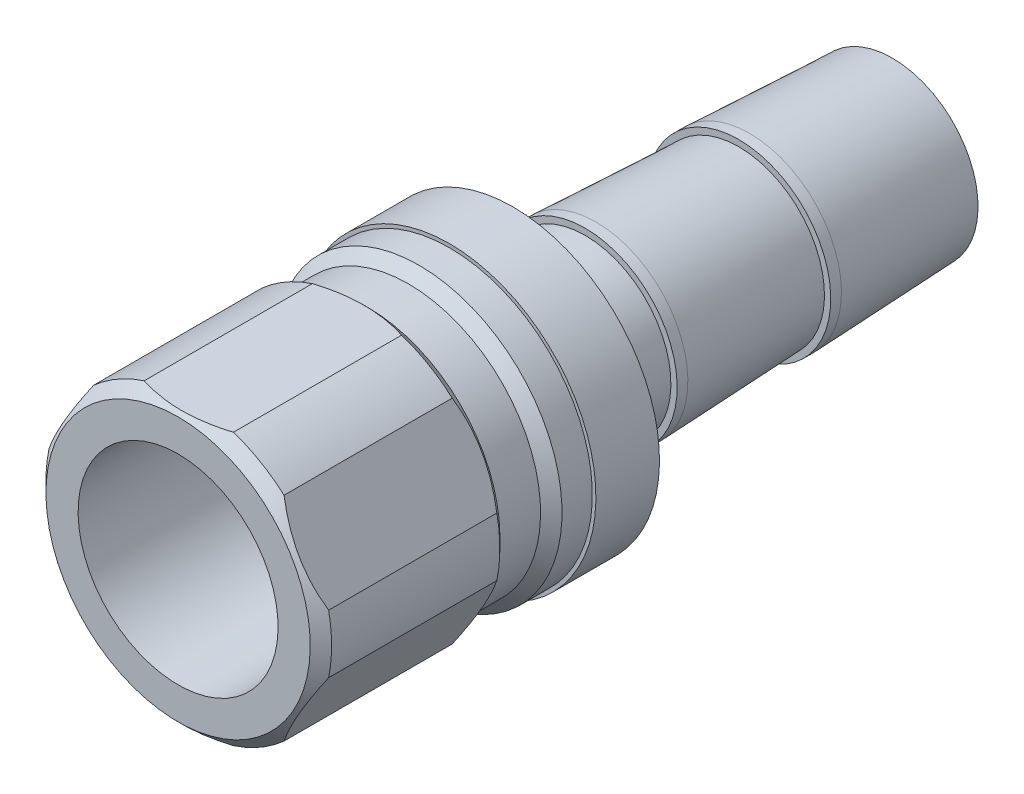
SolidWorks part; units mm, degrees
ref_plane "Front Plane" through (0, 0, 0) normal (0, 0, 1) x (1, 0, 0)
ref_plane "Top Plane" through (0, 0, 0) normal (0, 1, 0) x (1, 0, 0)
ref_plane "Right Plane" through (0, 0, 0) normal (1, 0, 0) x (0, 0, -1)
sketch "Sketch1" plane through (0, 0, 0) normal (1, 0, 0) x (0, 0, -1)
  line L0 (0, 0) -> (-22.479, 0) construction
  line L1 (-19.304, 7.112) -> (-19.304, 9.398)
  line L2 (-5.8166, 9.398) -> (-5.8166, 0) construction
  line L3 (-18.542, 10.16) -> (-6.5786, 10.16)
  line L4 (0, 10.414) -> (0, 0) construction
  line L5 (-5.8166, 9.398) -> (-2.921, 9.398)
  line L6 (-2.159, 10.16) -> (0, 10.16)
  line L8 (-5.8166, 9.398) -> (-6.5786, 10.16)
  line L9 (-2.921, 9.398) -> (-2.159, 10.16)
  line L10 (-19.304, 9.398) -> (-18.542, 10.16)
  line L11 (-3.6608, 5.1594) -> (31.496, 5.1594)
  line L13 (7.366, 6.096) -> (9.652, 6.096)
  line L14 (31.496, 6.096) -> (31.496, 5.1594)
  line L15 (43.2463, 0) -> (0, 0) construction
  line L16 (-19.304, 7.112) -> (-4.699, 7.112)
  line L17 (-4.699, 7.112) -> (-3.6608, 5.1594)
  line L18 (9.652, 6.096) -> (9.652, 6.5405)
  line L19 (9.652, 6.5405) -> (10.414, 6.5405)
  line L20 (10.414, 6.5405) -> (20.574, 6.096)
  line L21 (20.574, 6.096) -> (20.574, 6.5405)
  line L22 (20.574, 6.5405) -> (21.336, 6.5405)
  line L23 (21.336, 6.5405) -> (31.496, 6.096)
  line L24 (0, 10.16) -> (0, 10.414)
  line L25 (0, 10.414) -> (4.5212, 10.414)
  line L26 (4.5212, 10.414) -> (4.5212, 6.5405)
  line L27 (4.5212, 6.5405) -> (7.366, 6.096)
  dimension "D2" = 2.8956
  dimension "D3" = 0.762
  dimension "D4" = 45
  dimension "D5" = 13.4874
  dimension "D6" = 45
  dimension "D7" = 13.081
  dimension "D8" = 12.192
  dimension "D9" = 50.8
  dimension "D10" = 10.922
  dimension "D11" = 0.762
  dimension "D12" = 10.3187
  dimension "D13" = 2.286
  dimension "D14" = 20.32
  dimension "D15" = 118
  dimension "D16" = 14.224
  dimension "D17" = 14.605
  dimension "D18" = 20.828
  dimension "D19" = 26.9748
  dimension "D20" = 19.304
revolve "Revolve1" add sketch "Sketch1" angle 360 about L0
sketch "Sketch2" plane through (0, 0, 19.304) normal (0, 0, 1) x (1, 0, 0)
  line L1 (5.5726, 9.652) -> (-5.5726, 9.652)
  line L2 (-5.5726, 9.652) -> (-11.1452, 0)
  line L3 (-11.1452, 0) -> (-5.5726, -9.652)
  line L4 (-5.5726, -9.652) -> (5.5726, -9.652)
  line L5 (5.5726, -9.652) -> (11.1452, 0)
  line L6 (11.1452, 0) -> (5.5726, 9.652)
  circle A0 centre (0, 0) radius 9.652 construction
  point P1 (-5.2503, 22.294)
  dimension "D1" = 19.304
extrude "Cut-Extrude1" cut sketch "Sketch2" against normal blind 15.875 flip side to cut
